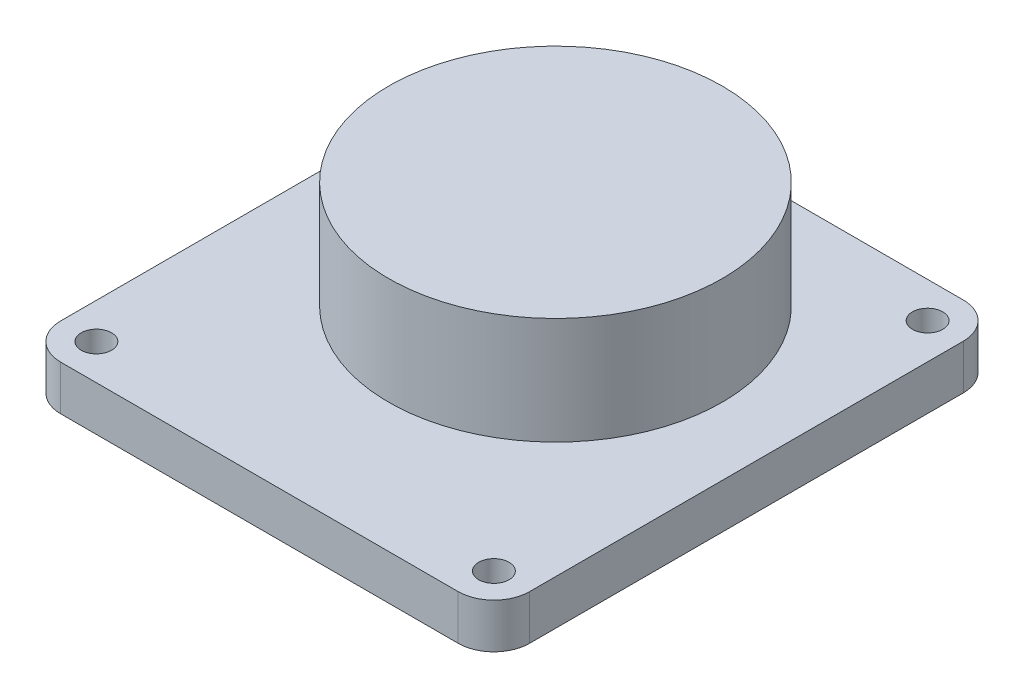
SolidWorks part; units mm, degrees
ref_plane "Front Plane" through (0, 0, 0) normal (0, 0, 1) x (1, 0, 0)
ref_plane "Top Plane" through (0, 0, 0) normal (0, 1, 0) x (1, 0, 0)
ref_plane "Right Plane" through (0, 0, 0) normal (1, 0, 0) x (0, 0, -1)
sketch "Sketch1" plane through (0, 0, 0) normal (0, 1, 0) x (1, 0, 0)
  line L1 (2.54, -2.54) -> (30.8229, -2.54)
  line L2 (0, 0) -> (0, 30.861)
  line L3 (2.54, 33.401) -> (30.8229, 33.401)
  line L4 (33.3629, 0) -> (33.3629, 30.861)
  arc A0 (0, 0) -> (2.54, -2.54) centre (2.54, 0) ccw
  arc A1 (0, 30.861) -> (2.54, 33.401) centre (2.54, 30.861) cw
  arc A2 (30.8229, 33.401) -> (33.3629, 30.861) centre (30.8229, 30.861) cw
  arc A3 (33.3629, 0) -> (30.8229, -2.54) centre (30.8229, 0) cw
  circle A4 centre (2.54, 30.861) radius 1.0795
  circle A5 centre (30.8229, 30.861) radius 1.0795
  circle A6 centre (30.8229, 0) radius 1.0795
  circle A7 centre (2.54, 0) radius 1.0795
  dimension "D3" = 2.54
  dimension "D4" = 2.159
  dimension "D1" = 35.941
  dimension "D2" = 33.3629
extrude "Boss-Extrude1" add sketch "Sketch1" along normal blind 3.1877
sketch "Sketch2" plane through (0, 3.1877, 0) normal (0, 1, 0) x (1, 0, 0)
  line L0 (30.8229, 33.401) -> (2.54, 33.401) construction
  circle A0 centre (16.6814, 18.523) radius 11.8682
  point P3 (16.6814, 30.3911)
  point P6 (16.6814, 33.401)
  dimension "D1" = 23.7363
  dimension "D2" = 3.0099
extrude "Boss-Extrude2" add sketch "Sketch2" along normal blind 7.62
